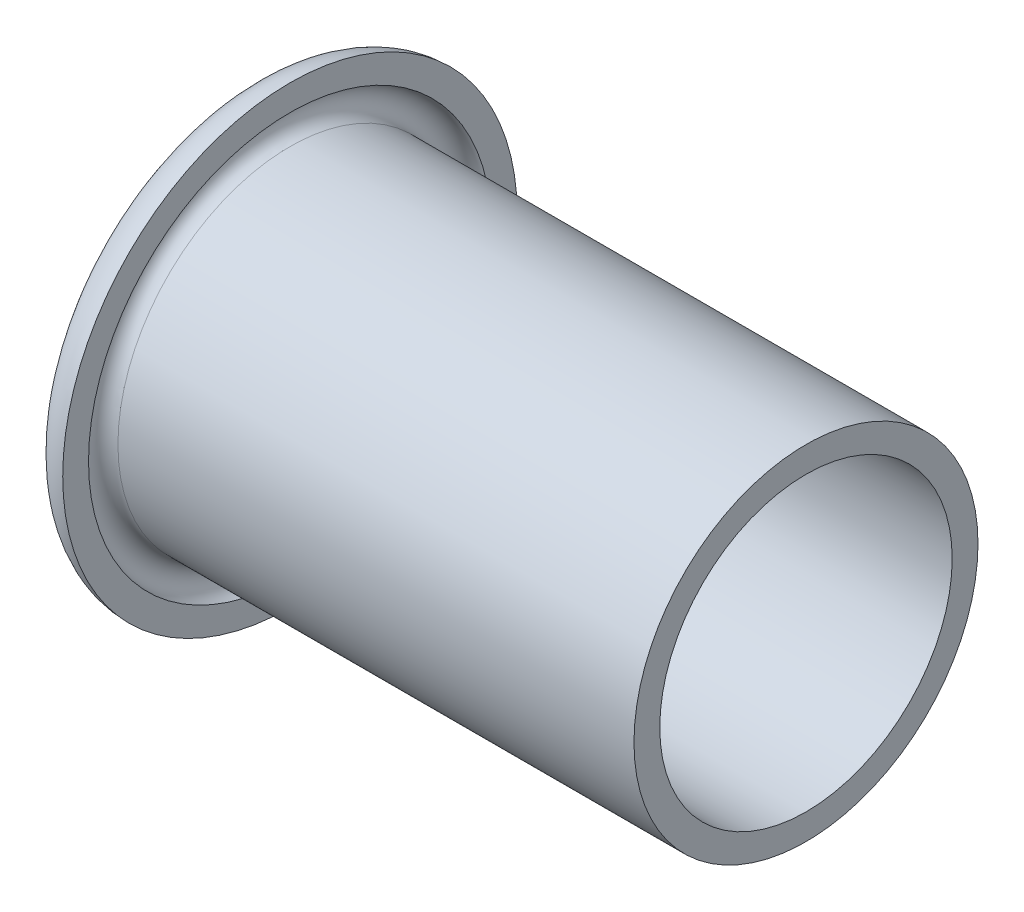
SolidWorks part; units mm, degrees
ref_plane "Front" through (0, 0, 0) normal (0, 0, 1) x (1, 0, 0)
ref_plane "Top" through (0, 0, 0) normal (0, 1, 0) x (1, 0, 0)
ref_plane "Right" through (0, 0, 0) normal (1, 0, 0) x (0, 0, -1)
other "Configuration Table"
sketch "Sketch1" plane through (0, 0, 0) normal (0, 0, 1) x (1, 0, 0)
  line L0 (-26.7513, 0) -> (46.6014, 0) construction
  line L1 (32.355, 8.5) -> (32.355, 10)
  line L2 (32.355, 10) -> (2.355, 10)
  line L3 (2.355, 11.71) -> (2.355, 13.21)
  line L4 (32.355, 8.5) -> (2.355, 8.5)
  line L5 (0, 10.855) -> (0, -3.4694) construction
  arc A0 (2.355, 13.21) -> (2.355, 8.5) centre (2.355, 10.855) ccw
  arc A1 (2.355, 10) -> (2.355, 11.71) centre (2.355, 10.855) cw
  dimension "dk" = 26.42
  dimension "d" = 20
  dimension "δ" = 1.5
  dimension "l" = 30
revolve "Base-Revolve" add sketch "Sketch1" angle 360 about L0
